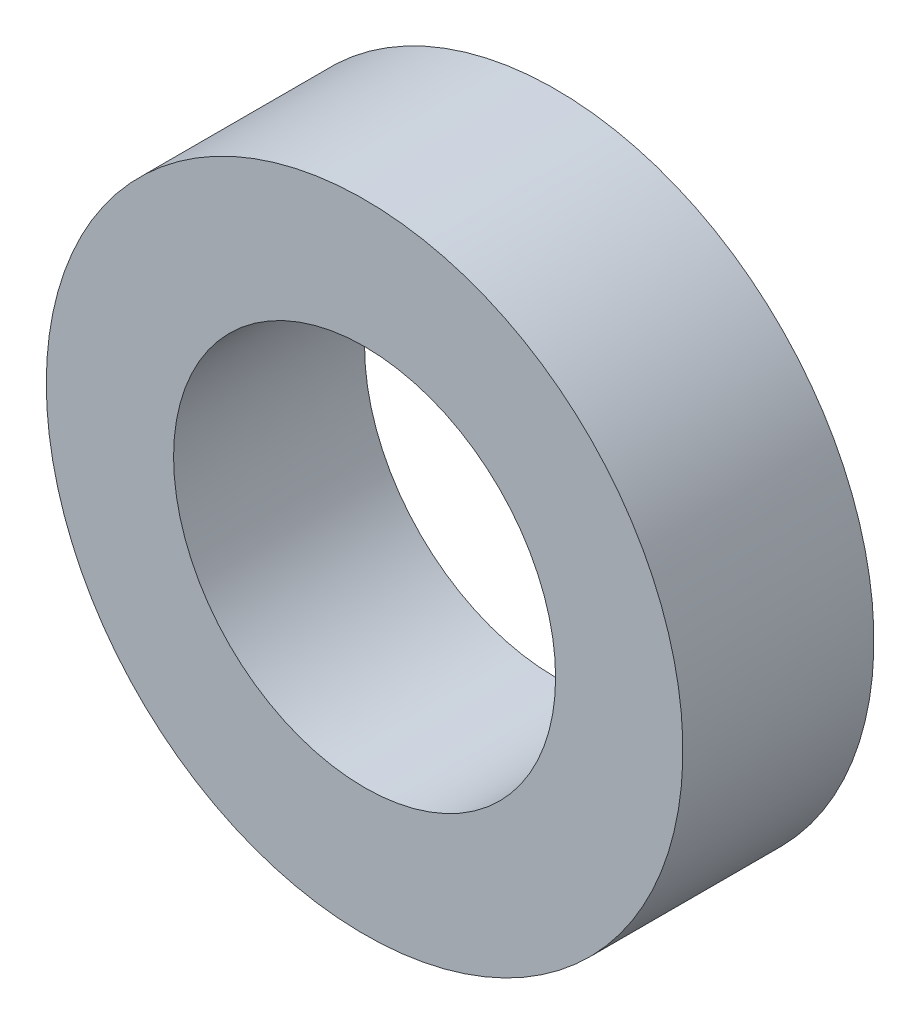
SolidWorks part; units mm, degrees
ref_plane "Front Plane" through (0, 0, 0) normal (0, 0, 1) x (1, 0, 0)
ref_plane "Top Plane" through (0, 0, 0) normal (0, 1, 0) x (1, 0, 0)
ref_plane "Right Plane" through (0, 0, 0) normal (1, 0, 0) x (0, 0, -1)
sketch "Sketch1" plane through (0, 0, 0) normal (0, 0, 1) x (1, 0, 0)
  circle A0 centre (0, 0) radius 2.9997
  circle A1 centre (0, 0) radius 4.9987
  dimension "D1" = 5.9995
  dimension "D2" = 9.9974
extrude "Extrude1" add sketch "Sketch1" along normal blind 2.9997
